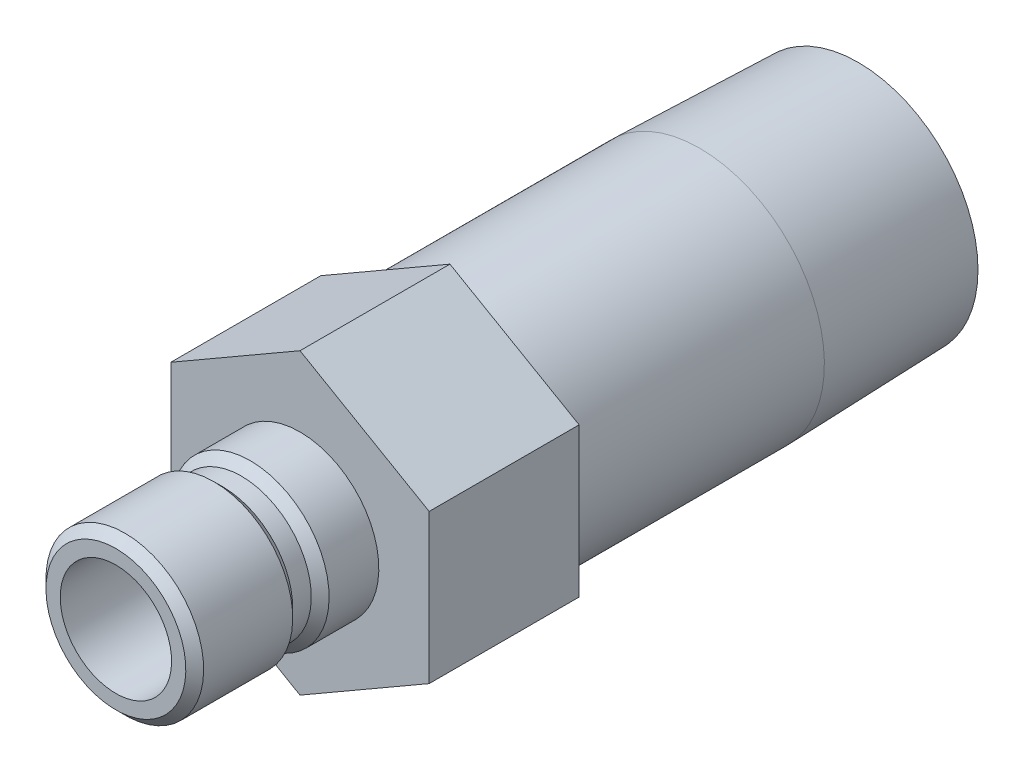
SolidWorks part; units mm, degrees
ref_plane "Front Plane" through (0, 0, 0) normal (0, 0, 1) x (1, 0, 0)
ref_plane "Top Plane" through (0, 0, 0) normal (0, 1, 0) x (1, 0, 0)
ref_plane "Right Plane" through (0, 0, 0) normal (1, 0, 0) x (0, 0, -1)
sketch "Sketch1" plane through (0, 0, 0) normal (1, 0, 0) x (0, 0, -1)
  line L0 (0, 0) -> (-18.923, 0) construction
  line L1 (-15.748, 4.7625) -> (-15.748, 5.9817)
  line L2 (-6.604, 5.9817) -> (-6.604, 0) construction
  line L3 (-14.986, 6.7437) -> (-7.366, 6.7437)
  line L4 (0, 10.668) -> (0, 0) construction
  line L5 (-6.604, 5.9817) -> (-5.0165, 5.9817)
  line L6 (-4.2545, 6.7437) -> (0, 6.7437)
  line L7 (0, 6.7437) -> (0, 10.668)
  line L8 (-6.604, 5.9817) -> (-7.366, 6.7437)
  line L9 (-5.0165, 5.9817) -> (-4.2545, 6.7437)
  line L10 (-15.748, 5.9817) -> (-14.986, 6.7437)
  line L11 (-15.748, 4.7625) -> (12.827, 4.7625)
  line L12 (0, 10.668) -> (34.1884, 10.668)
  line L13 (34.1884, 10.668) -> (47.752, 10.2441)
  line L14 (47.752, 10.2441) -> (47.752, 7.8994)
  line L15 (0, 6.7437) -> (12.827, 6.7437) construction
  line L16 (12.827, 6.7437) -> (12.827, 0) construction
  line L17 (12.827, 0) -> (0, 0) construction
  line L18 (12.827, 4.7625) -> (12.827, 7.8994)
  line L19 (12.827, 7.8994) -> (47.752, 7.8994)
  dimension "D1" = 15.748
  dimension "D2" = 1.5875
  dimension "D3" = 0.762
  dimension "D4" = 45
  dimension "D5" = 9.144
  dimension "D6" = 45
  dimension "D7" = 1.79
  dimension "D8" = 13.5636
  dimension "D9" = 63.5
  dimension "D10" = 3.175
  dimension "D11" = 9.525
  dimension "D12" = 21.336
  dimension "D13" = 28.575
  dimension "D14" = 13.4874
  dimension "D15" = 15.7988
revolve "Revolve1" add sketch "Sketch1" angle 360 about L0
sketch "Sketch2" plane through (0, 0, 0) normal (0, 0, 1) x (1, 0, 0)
  line L1 (-11.049, 6.3791) -> (-11.049, -6.3791)
  line L2 (-11.049, -6.3791) -> (0, -12.7583)
  line L3 (0, -12.7583) -> (11.049, -6.3791)
  line L4 (11.049, -6.3791) -> (11.049, 6.3791)
  line L5 (11.049, 6.3791) -> (0, 12.7583)
  line L6 (0, 12.7583) -> (-11.049, 6.3791)
  circle A0 centre (0, 0) radius 11.049 construction
  circle A1 centre (0, 0) radius 4.7625 construction
  circle A2 centre (0, 0) radius 4.7625
  dimension "D1" = 22.098
extrude "Boss-Extrude1" add sketch "Sketch2" against normal up to vertex (12.827 mm away) from vertex at 0
